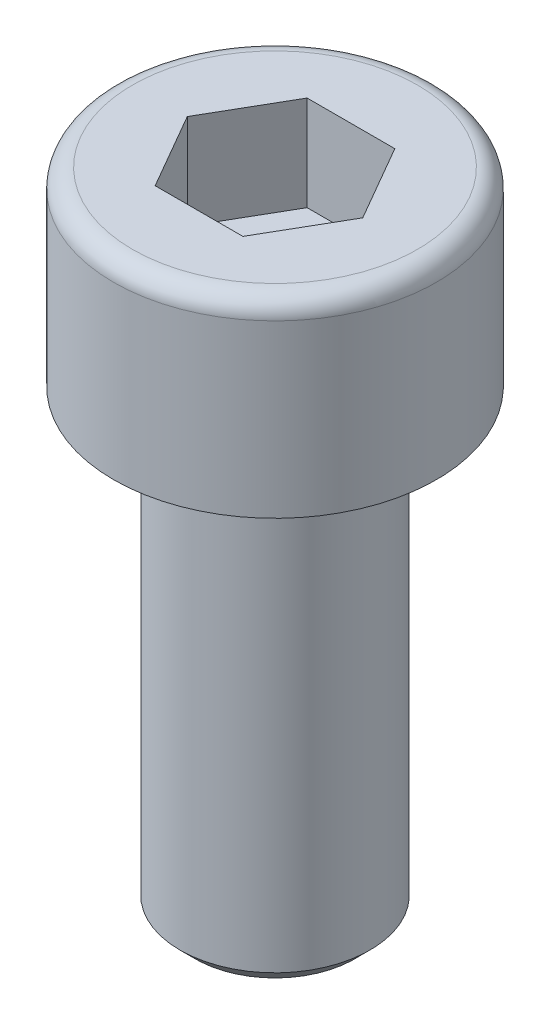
SolidWorks part; units mm, degrees
ref_plane "Plan1" through (0, 0, 0) normal (0, 0, 1) x (1, 0, 0)
ref_plane "Plan2" through (0, 0, 0) normal (0, 1, 0) x (1, 0, 0)
ref_plane "Plan3" through (0, 0, 0) normal (1, 0, 0) x (0, 0, -1)
sketch "Esquisse1" plane through (0, 0, 0) normal (0, 0, 1) x (1, 0, 0)
  line L0 (0, 50) -> (0, -40) construction
  line L1 (0, 17) -> (-3.75, 17)
  line L3 (-4.25, 16.5) -> (-4.25, 12)
  line L4 (-4.25, 12) -> (-2.5, 12)
  line L7 (-2.5, 12) -> (-2.5, 0)
  line L12 (-2.5, 0) -> (0, 0)
  line L13 (0, 17) -> (0, 0)
  arc A0 (-4.25, 16.5) -> (-3.75, 17) centre (-3.75, 16.5) cw
  dimension "D1" = 0.5
  dimension "D2" = 4.25
  dimension "D3" = 12
  dimension "D4" = 5
  dimension "D7" = 2.5
revolve "Base-Révolution" add sketch "Esquisse1" angle 360 about L0
sketch "Esquisse2" plane through (0, 17, 0) normal (0, 1, 0) x (-1, 0, 0)
  line L0 (2.3094, 0) -> (-2.3094, 0) construction
  line L1 (1.1547, 2) -> (-1.1547, -2) construction
  line L2 (1.1547, -2) -> (-1.1547, 2) construction
  line L3 (-1.1547, -2) -> (1.1547, -2)
  line L4 (1.1547, -2) -> (2.3094, 0)
  line L5 (2.3094, 0) -> (1.1547, 2)
  line L6 (1.1547, 2) -> (-1.1547, 2)
  line L7 (-1.1547, 2) -> (-2.3094, 0)
  line L8 (-2.3094, 0) -> (-1.1547, -2)
  dimension "D1" = 4
extrude "Enlèv. mat.-Extru.1" cut sketch "Esquisse2" against normal blind 2.5
chamfer "Chanfrein1" distance 0.4 angle 45
